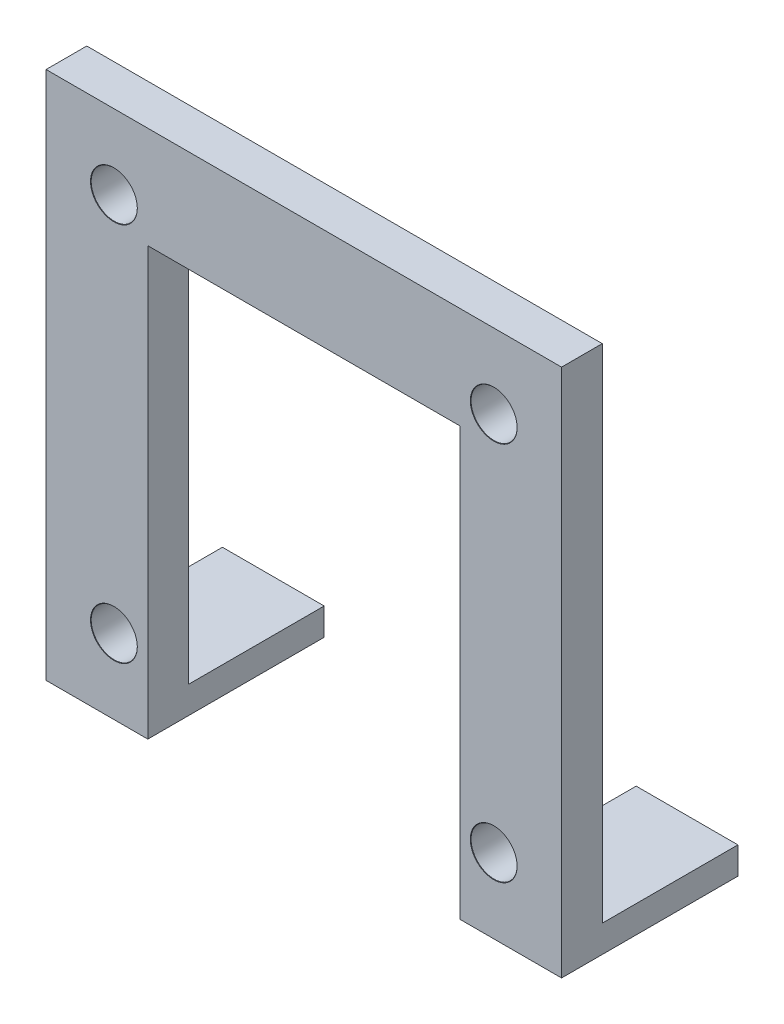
SolidWorks part; units mm, degrees
ref_plane "Front Plane" through (0, 0, 0) normal (0, 0, 1) x (1, 0, 0)
ref_plane "Top Plane" through (0, 0, 0) normal (0, 1, 0) x (1, 0, 0)
ref_plane "Right Plane" through (0, 0, 0) normal (1, 0, 0) x (0, 0, -1)
sketch "Sketch2" plane through (0, 0, 0) normal (0, 0, 1) x (1, 0, 0)
  line L5 (0, 0) -> (0, 39)
  line L6 (0, 39) -> (38, 39)
  line L11 (38, 39) -> (38, 0)
  line L12 (38, 0) -> (30.5, 0)
  line L15 (30.5, 0) -> (30.5, 31.5)
  line L16 (30.5, 31.5) -> (7.5, 31.5)
  line L17 (7.5, 31.5) -> (7.5, 0)
  line L18 (7.5, 0) -> (0, 0)
  line L19 (19, 31.5) -> (19, 39) construction
  dimension "D1" = 23
  dimension "D3" = 38
  dimension "D4" = 39
extrude "Boss-Extrude1" add sketch "Sketch2" along normal blind 3
hole_wizard "M3 Clearance Hole1" positions "Sketch3" profile "Sketch4" hole size "M3" standard "ANSI Metric"
sketch "Sketch3" plane through (0, 0, 3) normal (0, 0, 1) x (1, 0, 0)
  line L0 (0, 19.5) -> (38, 19.5) construction
  line L1 (0, 39) -> (0, 0) construction
  line L2 (38, 0) -> (38, 39) construction
  line L4 (19, 39) -> (19, 0) construction
  line L5 (38, 39) -> (0, 39) construction
  line L7 (0, 0) -> (38, 0) construction
  line L10 (33, 5.5) -> (5, 5.5)
  line L11 (33, 5.5) -> (33, 33.5)
  line L12 (33, 33.5) -> (5, 33.5)
  line L13 (5, 5.5) -> (5, 33.5)
  line L14 (33, 5.5) -> (5, 33.5) construction
  line L15 (33, 33.5) -> (5, 5.5) construction
  point P20 (19, 19.5)
  point P21 (5, 33.5)
  point P150 (33, 5.5)
  point P151 (33, 33.5)
  point P152 (5, 5.5)
  dimension "D1" = 28
  dimension "D2" = 28
sketch "Sketch4" plane through (5, 5.5, 3) normal (1, 0, 0) x (0, -1, 0)
  line L0 (0, 0) -> (0, 3)
  line L1 (0, 3) -> (1.7, 3)
  line L2 (1.7, 3) -> (1.7, 0.025)
  line L3 (1.7, 0.025) -> (1.725, 0)
  line L5 (1.725, 0) -> (0, 0)
  line L6 (-1.7, 0.025) -> (-1.725, 0) construction
  line L11 (0, -6.35) -> (0, 107.95) construction
  dimension "Thru Hole Dia." = 3.4
  dimension "Thru Hole Depth" = 3
  dimension "Near C'Sink Dia." = 3.45
  dimension "Near C'Sink Angle" = 90
sketch "Sketch14" plane through (0, 0, 0) normal (0, 0, -1) x (-1, 0, 0)
  line L0 (-30.5, 0) -> (-30.5, 2)
  line L1 (-30.5, 31.5) -> (-30.5, 0) construction
  line L2 (-30.5, 2) -> (-38, 2)
  line L3 (-38, 0) -> (-38, 39) construction
  line L4 (-38, 2) -> (-38, 0)
  line L5 (-38, 0) -> (-30.5, 0)
  line L6 (-7.5, 0) -> (0, 0)
  line L7 (0, 0) -> (0, 2)
  line L8 (0, 39) -> (0, 0) construction
  line L9 (0, 2) -> (-7.5, 2)
  line L10 (-7.5, 0) -> (-7.5, 31.5) construction
  line L11 (-7.5, 2) -> (-7.5, 0)
  dimension "D1" = 2
extrude "Boss-Extrude3" add sketch "Sketch14" along normal blind 10
